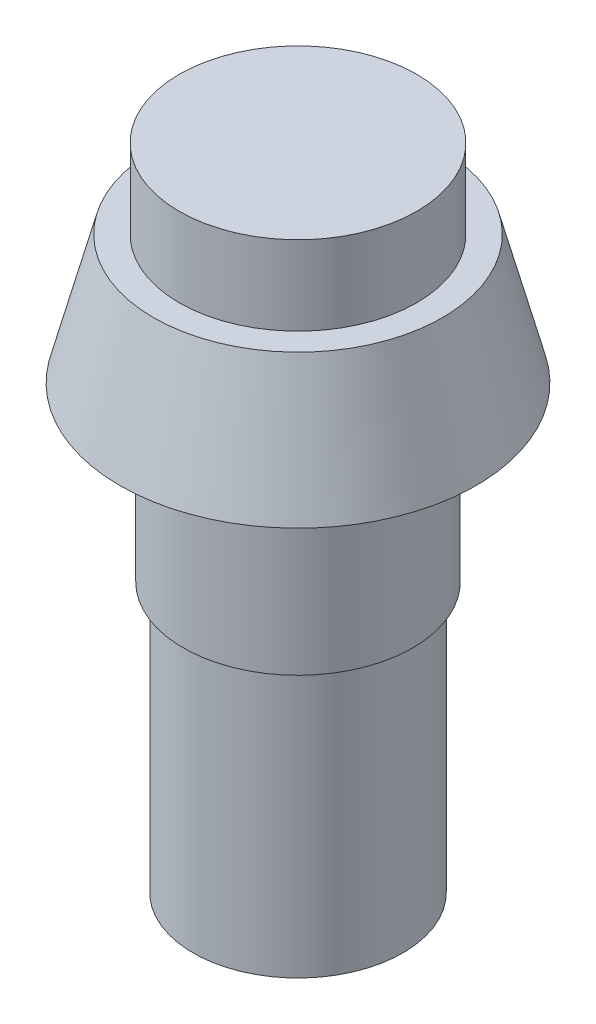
SolidWorks part; units mm, degrees
ref_plane "Front Plane" through (0, 0, 0) normal (0, 0, 1) x (1, 0, 0)
ref_plane "Top Plane" through (0, 0, 0) normal (0, 1, 0) x (1, 0, 0)
ref_plane "Right Plane" through (0, 0, 0) normal (1, 0, 0) x (0, 0, -1)
sketch "Sketch1" plane through (0, 0, 0) normal (0, 0, 1) x (1, 0, 0)
  line L0 (0, 0) -> (0, 10.5)
  line L1 (0, 10.5) -> (6, 10.5)
  line L2 (6, 10.5) -> (6, 6.5)
  line L3 (6, 6.5) -> (7.3, 6.5)
  line L4 (7.3, 6.5) -> (9, 0)
  line L5 (9, 0) -> (0, 0)
  line L6 (0, 0) -> (0, -8.7)
  line L7 (0, -8.7) -> (5.8, -8.7)
  line L8 (5.8, -8.7) -> (5.8, 0)
  line L9 (0, -8.7) -> (0, -22.3)
  line L10 (0, -22.3) -> (5.3, -22.3)
  line L11 (5.3, -22.3) -> (5.3, -8.7)
  dimension "D1" = 10.5
  dimension "D2" = 9
  dimension "D3" = 6
  dimension "D4" = 1.3
  dimension "D5" = 6.5
  dimension "D6" = 5.8
  dimension "D7" = 8.7
  dimension "D8" = 5.3
  dimension "D9" = 13.6
revolve "Revolve1" add sketch "Sketch1" angle 360 about L0
